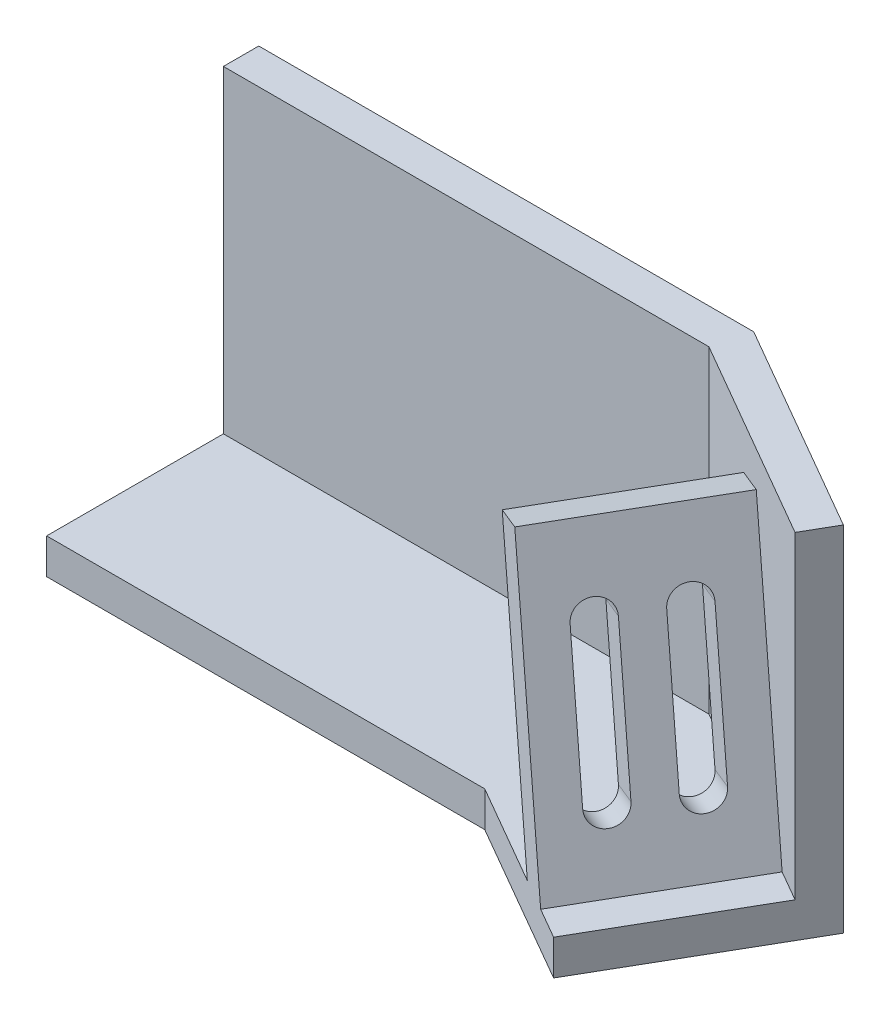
SolidWorks part; units mm, degrees
ref_plane "正面" through (0, 0, 0) normal (0, 0, 1) x (1, 0, 0)
ref_plane "平面" through (0, 0, 0) normal (0, 1, 0) x (1, 0, 0)
ref_plane "右側面" through (0, 0, 0) normal (1, 0, 0) x (0, 0, -1)
sketch "ｽｹｯﾁ1" plane through (0, 0, 0) normal (0, 1, 0) x (1, 0, 0)
  line L0 (0, 0) -> (70, 0)
  line L1 (70, 0) -> (100, -17.3205)
  line L2 (0, -30) -> (61.9615, -30)
  line L3 (61.9615, -30) -> (85, -43.3013)
  line L4 (0, -30) -> (0, 0)
  line L5 (100, -17.3205) -> (85, -43.3013)
  dimension "D1" = 150
  dimension "D2" = 70
  dimension "D3" = 100
  dimension "D4" = 30
extrude "ﾎﾞｽ - 押し出し1" add sketch "ｽｹｯﾁ1" along normal blind 50 contours L0 L1 L5 L3 L2 L4
shell "ｼｪﾙ1" thickness 5
sketch "ｽｹｯﾁ2" plane through (15, 0, -25.9808) normal (-0.5, 0, 0.866) x (0.866, 0, 0.5)
  line L0 (90.2628, 5) -> (85.1089, 5)
  line L1 (61.9615, 5) -> (95.2628, 5) construction
  line L2 (85.1089, 5) -> (75.4121, 43.7873)
  line L3 (75.4121, 43.7873) -> (80.2628, 45)
  line L4 (80.2628, 45) -> (90.2628, 5)
  line L5 (95.2628, 50) -> (95.2628, 5) construction
  dimension "D1" = 5
  dimension "D2" = 5
  dimension "D3" = 15
  dimension "D4" = 40
extrude "ﾎﾞｽ - 押し出し2" add sketch "ｽｹｯﾁ2" along normal up to surface (25 mm away)
sketch "ｽｹｯﾁ3" plane through (74.5905, 21.5324, 43.0648) normal (0.8402, 0.2425, 0.4851) x (0.466, 0.1345, -0.8745)
  line L0 (14.1763, 11.1001) -> (11.4028, -8.7066) construction
  line L1 (16.6521, 10.7534) -> (13.8786, -9.0533)
  line L2 (11.7004, 11.4468) -> (8.9269, -8.3599)
  line L3 (24.0797, 9.7134) -> (21.3062, -10.0934) construction
  line L4 (26.5555, 9.3667) -> (23.782, -10.4401)
  line L5 (21.6038, 10.0601) -> (18.8303, -9.7467)
  line L6 (20.6854, 21.5293) -> (14.9677, -19.3034) construction
  line L7 (8.3062, 23.2627) -> (33.0647, 19.7959) construction
  line L8 (2.5885, -17.57) -> (27.3469, -21.0368) construction
  arc A0 (16.6521, 10.7534) -> (11.7004, 11.4468) centre (14.1763, 11.1001) ccw
  arc A1 (8.9269, -8.3599) -> (13.8786, -9.0533) centre (11.4028, -8.7066) ccw
  arc A2 (26.5555, 9.3667) -> (21.6038, 10.0601) centre (24.0797, 9.7134) ccw
  arc A3 (18.8303, -9.7467) -> (23.782, -10.4401) centre (21.3062, -10.0934) ccw
  point P2 (12.7895, 1.1967)
  point P7 (22.6929, -0.19)
  dimension "D1" = 10
  dimension "D2" = 5
  dimension "D3" = 20
  dimension "D4" = 20
extrude "ｶｯﾄ - 押し出し1" cut sketch "ｽｹｯﾁ3" against normal up to next
